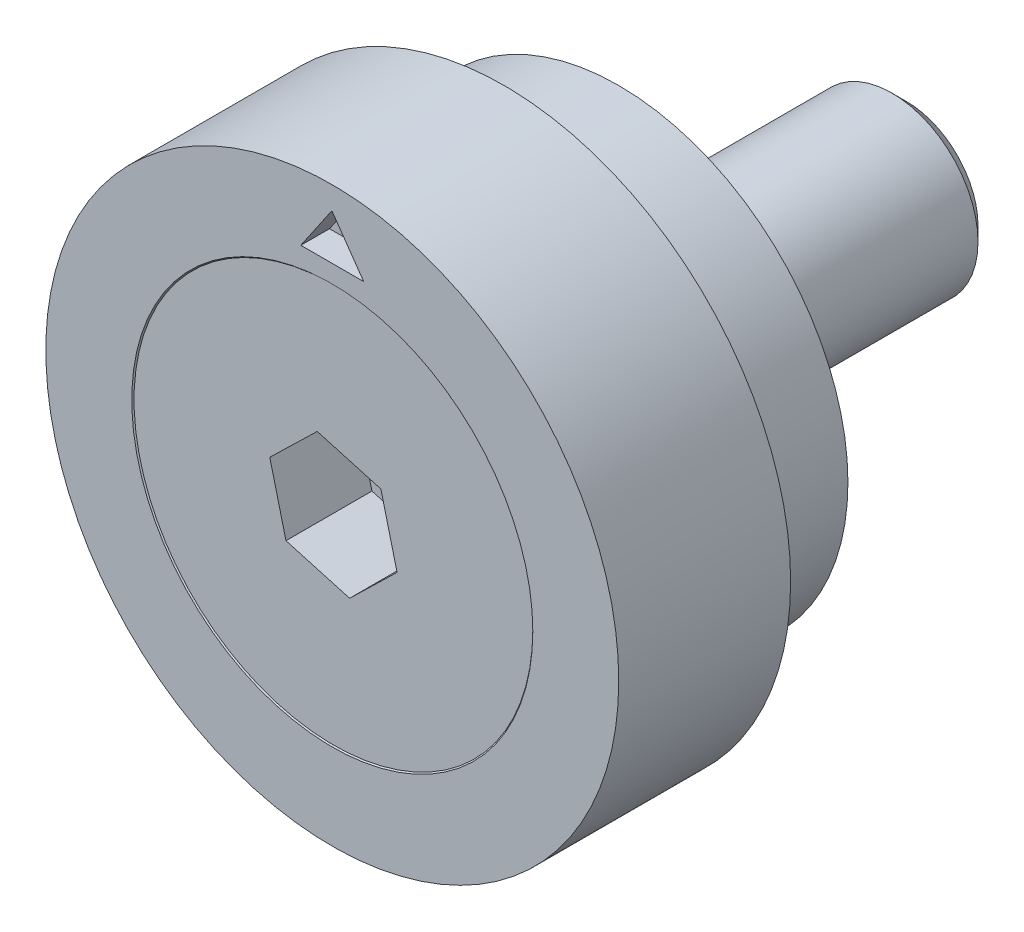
SolidWorks part; units mm, degrees
other "<M3 X .5 FHCS>-<Imported1>"
ref_plane "Front Plane" through (0, 0, 0) normal (0, 0, 1) x (1, 0, 0)
ref_plane "Top Plane" through (0, 0, 0) normal (0, 1, 0) x (1, 0, 0)
ref_plane "Right Plane" through (0, 0, 0) normal (1, 0, 0) x (0, 0, -1)
imported_body "Imported1"
inserted part "M3 X .5 FHCS"
move or copy body "Body-Move/Copy2" placed by mates yes
